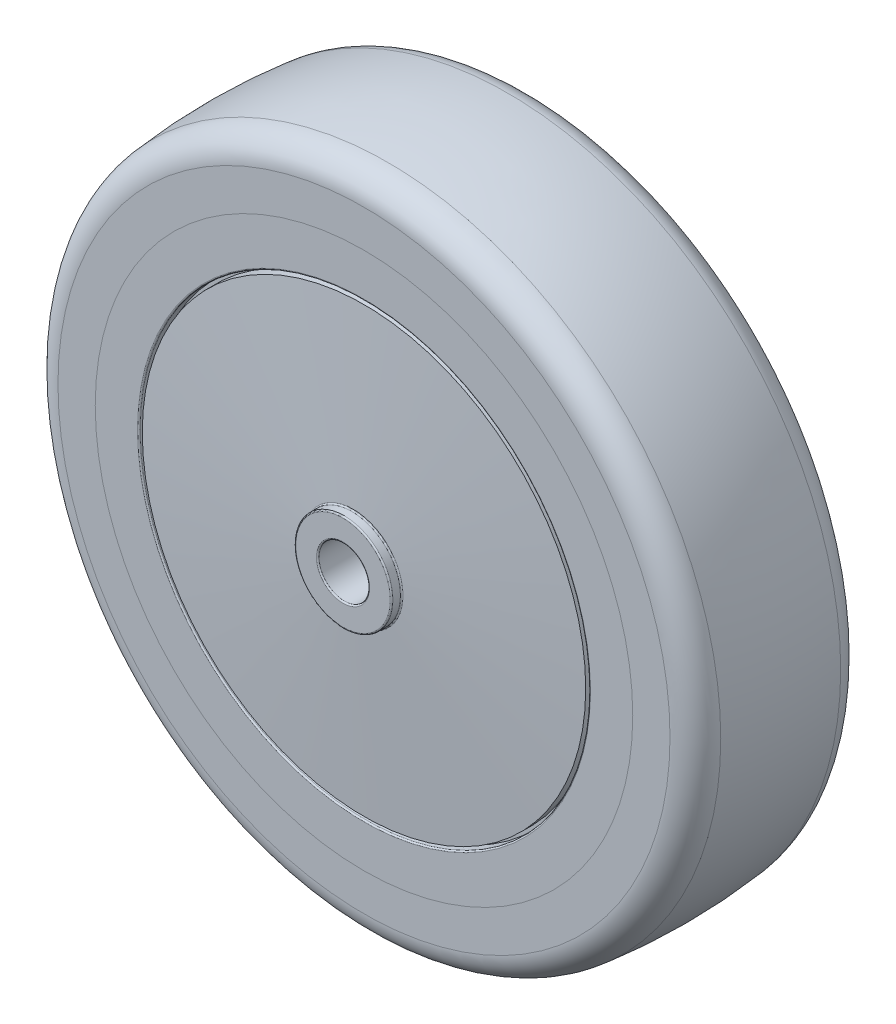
SolidWorks part; units mm, degrees
ref_plane "Front" through (0, 0, 0) normal (0, 0, 1) x (1, 0, 0)
ref_plane "Top" through (0, 0, 0) normal (0, 1, 0) x (1, 0, 0)
ref_plane "Right" through (0, 0, 0) normal (1, 0, 0) x (0, 0, -1)
sketch "Sketch1" plane through (0, 0, 0) normal (1, 0, 0) x (0, 0, -1)
  line L0 (-86.9689, 0) -> (85.6644, 0) construction
  line L1 (-15.875, -50.8) -> (-6.35, -50.8) construction
  line L2 (0, 146.7507) -> (0, -181.9168) construction
  line L3 (-6.35, -50.8) -> (-6.35, 0) construction
  line L4 (6.35, -50.8) -> (6.35, 0) construction
  line L5 (15.875, -50.8) -> (6.35, -50.8) construction
  line L6 (-15.875, -50.8) -> (-15.875, -62.3087)
  line L8 (15.875, -50.8) -> (15.875, -62.3087)
  line L9 (-6.35, 0) -> (6.35, 0)
  line L11 (-13.97, 0) -> (-6.35, 0)
  line L13 (13.97, 0) -> (6.35, 0)
  line L14 (6.35, 0) -> (6.0757, 0.1021)
  line L17 (-13.97, 0) -> (-13.97, -50.8)
  line L18 (-13.97, -50.8) -> (-15.875, -50.8)
  line L19 (13.97, -50.8) -> (15.875, -50.8)
  line L22 (13.97, 0) -> (13.97, -50.8)
  arc A0 (15.875, -62.3087) -> (-15.875, -62.3087) centre (0, 42.8691) cw
  point P13 (0, -63.5)
  point P18 (0, -63.5)
  dimension "D2" = 106.3691
  dimension "D1" = 31.75
  dimension "D3" = 63.5
  dimension "D4" = 12.7
  dimension "D5" = 12.7
  dimension "D6" = 27.94
revolve "Revolve1" add sketch "Sketch1" angle 360 about L0
sketch "Sketch88" plane through (0, 0, 0) normal (1, 0, 0) x (0, 0, -1)
  line L0 (0, 0) -> (45.7457, 0) construction
  line L1 (-19.8438, 0) -> (19.8438, 0)
  line L2 (-19.8437, 9.1821) -> (-17.9387, 9.1821)
  line L3 (0, 0) -> (0, 41.91) construction
  line L4 (-17.9387, 9.1821) -> (-15.875, 41.91)
  line L5 (19.8437, 9.1821) -> (19.8438, 0)
  line L6 (-15.875, 41.91) -> (15.875, 41.91)
  line L7 (19.8437, 9.1821) -> (17.9387, 9.1821)
  line L8 (-19.8437, 9.1821) -> (-19.8438, 0)
  line L9 (17.9387, 9.1821) -> (15.875, 41.91)
  line L10 (-15.875, 62.3087) -> (-15.875, -62.3087) construction
  point P10 (0, 0)
  dimension "D1" = 39.6875
  dimension "D2" = 9.1821
  dimension "D3" = 1.905
  dimension "D4" = 41.91
revolve "Revolve2" add sketch "Sketch88" angle 360 about L0
sketch "Sketch26" plane through (0, 0, 0) normal (0, 0, 1) x (1, 0, 0)
  circle A0 centre (0, 0) radius 4.7625
  dimension "D1" = 9.525
extrude "Cut-Extrude1" cut sketch "Sketch26" against normal through all both and the other way through all
fillet "Fillet15" radius 5.08 2 edges at (62.3087, 0, 15.875) (62.3087, 0, -15.875)
sketch "Sketch89" plane through (0, 0, 15.875) normal (0, 0, 1) x (1, 0, 0)
  line L0 (0, 0) -> (-41.91, 0) construction
  line L1 (-41.91, 0) -> (-42.545, 0) construction
  circle A0 centre (0, 0) radius 50.8
  circle A1 centre (0, 0) radius 42.545
  circle A2 centre (0, 0) radius 50.8 construction
  circle A3 centre (0, 0) radius 41.91 construction
  dimension "D1" = 0.635
extrude "Boss-Extrude4" add sketch "Sketch89" against normal up to surface (31.75 mm away) separate body
fillet "Fillet16" radius 0.254 2 edges at (42.545, 0, 15.875) (42.545, 0, -15.875)
fillet "Fillet17" radius 0.254 6 edges at (4.7625, 0, 19.8437) (9.1821, 0, 17.9387) (9.1821, 0, -17.9387) (4.7625, 0, -19.8437) (9.1821, 0, -19.8437) (9.1821, 0, 19.8437)
